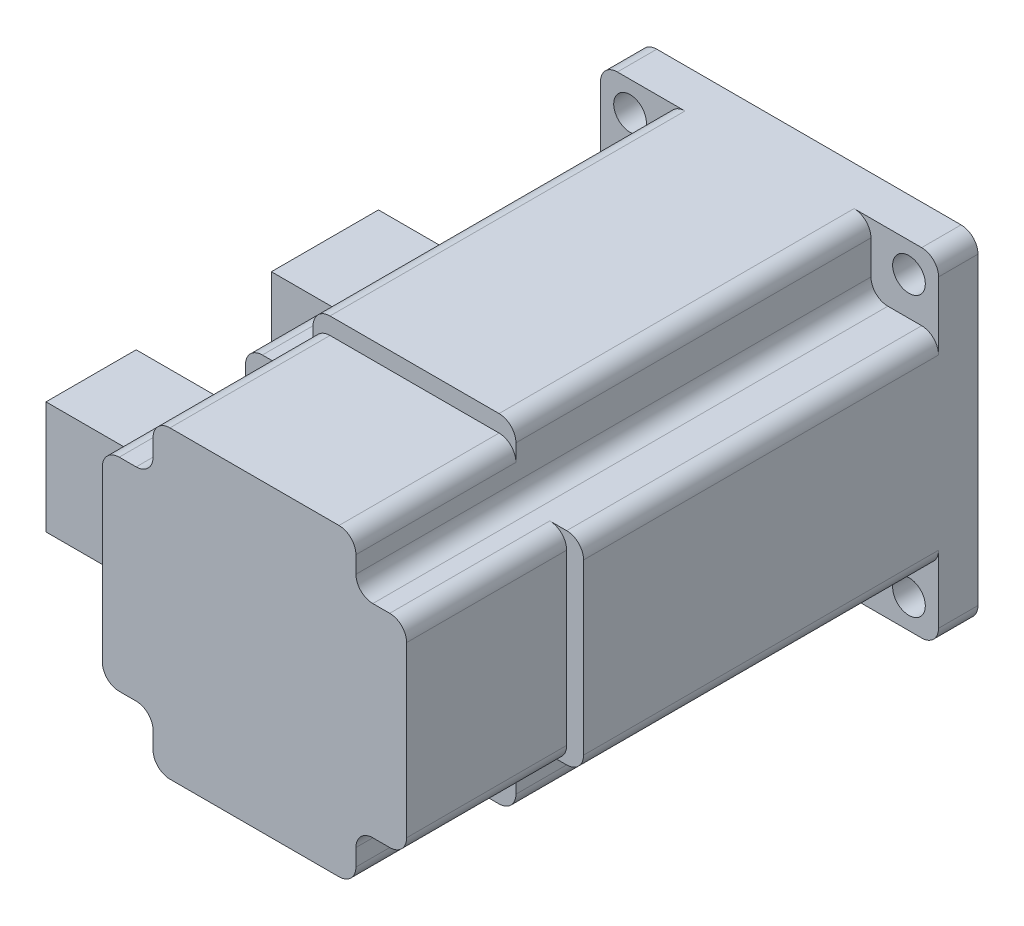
SolidWorks part; units mm, degrees
ref_plane "前视基准面" through (0, 0, 0) normal (0, 0, 1) x (1, 0, 0)
ref_plane "上视基准面" through (0, 0, 0) normal (0, 1, 0) x (1, 0, 0)
ref_plane "右视基准面" through (0, 0, 0) normal (1, 0, 0) x (0, 0, -1)
sketch "草图1" plane through (0, 0, 0) normal (0, 0, 1) x (1, 0, 0)
  line L0 (0, 27) -> (0, -27) construction
  line B0 (24, -18) -> (27, -18)
  line B1 (30, -15) -> (30, 15)
  line B2 (27, 18) -> (24, 18)
  line B3 (18, 24) -> (18, 27)
  line B4 (15, 30) -> (-15, 30)
  line B5 (-18, 27) -> (-18, 24)
  line B6 (-27, -18) -> (-24, -18)
  line B7 (-24, 18) -> (-27, 18)
  line B8 (-30, 15) -> (-30, -15)
  line B9 (-18, -24) -> (-18, -27)
  line B10 (-15, -30) -> (15, -30)
  line B11 (18, -27) -> (18, -24)
  line B12 (18, 21) -> (18, 24)
  line B13 (21, 18) -> (24, 18)
  line B14 (-18, 21) -> (-18, 24)
  line B15 (-24, 18) -> (-21, 18)
  line B16 (-24, -18) -> (-21, -18)
  line B17 (-18, -24) -> (-18, -21)
  line B18 (21, -18) -> (24, -18)
  line B19 (18, -24) -> (18, -21)
  arc B20 (27, -18) -> (30, -15) centre (27, -15) ccw
  arc B21 (30, 15) -> (27, 18) centre (27, 15) ccw
  arc B22 (18, 27) -> (15, 30) centre (15, 27) ccw
  arc B23 (-15, 30) -> (-18, 27) centre (-15, 27) ccw
  arc B24 (-27, 18) -> (-30, 15) centre (-27, 15) ccw
  arc B25 (-30, -15) -> (-27, -18) centre (-27, -15) ccw
  arc B26 (-18, -27) -> (-15, -30) centre (-15, -27) ccw
  arc B27 (15, -30) -> (18, -27) centre (15, -27) ccw
  arc B28 (18, 21) -> (21, 18) centre (21, 21) ccw
  arc B29 (-21, 18) -> (-18, 21) centre (-21, 21) ccw
  arc B30 (-18, -21) -> (-21, -18) centre (-21, -21) ccw
  arc B31 (21, -18) -> (18, -21) centre (21, -21) ccw
sketch_block_instance "块1-1"
sketch_block "块1"
extrude "凸台-拉伸1" add sketch "草图1" along normal blind 91.4
sketch "草图2" plane through (0, 0, 91.4) normal (0, 0, 1) x (1, 0, 0)
  line L0 (0, 27) -> (0, -27) construction
  line B0 (-15, -27) -> (15, -27)
  line B1 (18, -24) -> (18, -21)
  line B2 (21, -18) -> (24, -18)
  line B3 (27, -15) -> (27, 15)
  line B4 (24, 18) -> (21, 18)
  line B5 (18, 21) -> (18, 24)
  line B6 (15, 27) -> (-15, 27)
  line B7 (-18, 24) -> (-18, 21)
  line B8 (-21, 18) -> (-24, 18)
  line B9 (-27, 15) -> (-27, -15)
  line B10 (-24, -18) -> (-21, -18)
  line B11 (-18, -21) -> (-18, -24)
  arc B12 (15, -27) -> (18, -24) centre (15, -24) ccw
  arc B13 (21, -18) -> (18, -21) centre (21, -21) ccw
  arc B14 (24, -18) -> (27, -15) centre (24, -15) ccw
  arc B15 (27, 15) -> (24, 18) centre (24, 15) ccw
  arc B16 (18, 21) -> (21, 18) centre (21, 21) ccw
  arc B17 (18, 24) -> (15, 27) centre (15, 24) ccw
  arc B18 (-15, 27) -> (-18, 24) centre (-15, 24) ccw
  arc B19 (-21, 18) -> (-18, 21) centre (-21, 21) ccw
  arc B20 (-24, 18) -> (-27, 15) centre (-24, 15) ccw
  arc B21 (-27, -15) -> (-24, -18) centre (-24, -15) ccw
  arc B22 (-18, -21) -> (-21, -18) centre (-21, -21) ccw
  arc B23 (-18, -24) -> (-15, -27) centre (-15, -24) ccw
sketch_block_instance "块2-1"
sketch_block "块2"
extrude "切除-拉伸1" cut sketch "草图2" against normal blind 28.4 flip side to cut
sketch "草图3" plane through (0, 0, 0) normal (0, 0, -1) x (-1, 0, 0)
  line L0 (-15, 30) -> (15, 30) construction
  line L1 (-27, -30) -> (27, -30)
  line L2 (-30, -27) -> (-30, 27)
  line L3 (-27, 30) -> (27, 30)
  line L4 (30, -27) -> (30, 27)
  line L5 (-30, -30) -> (30, 30) construction
  line L6 (-30, 30) -> (30, -30) construction
  line L7 (30, 15) -> (30, -15) construction
  arc A0 (-27, -30) -> (-30, -27) centre (-27, -27) cw
  arc A1 (27, -30) -> (30, -27) centre (27, -27) ccw
  arc A2 (27, 30) -> (30, 27) centre (27, 27) cw
  arc A3 (-30, 27) -> (-27, 30) centre (-27, 27) cw
  point P0 (0, 0)
  dimension "D1" = 3
extrude "凸台-拉伸2" add sketch "草图3" along normal blind 7
sketch "草图4" plane through (0, 0, 0) normal (0, 0, 1) x (1, 0, 0)
  line L0 (0, 0) -> (0, 17.6698) construction
  line L1 (0, 0) -> (-15.3656, 0) construction
  circle A0 centre (-24.75, 24.75) radius 2.9
  circle A1 centre (24.75, 24.75) radius 2.9
  circle A2 centre (24.75, -24.75) radius 2.9
  circle A3 centre (-24.75, -24.75) radius 2.9
  dimension "D3" = 5.8
  dimension "D1" = 49.5
  dimension "D2" = 49.5
extrude "切除-拉伸2" cut sketch "草图4" against normal up to surface (7 mm away)
sketch "草图5" plane through (-30, 0, 0) normal (-1, 0, 0) x (0, 0, 1)
  line L0 (91.4, 15) -> (91.4, -15) construction
  line L1 (22.4, -10) -> (41.4, -10)
  line L2 (22.4, -10) -> (22.4, 10)
  line L3 (22.4, 10) -> (41.4, 10)
  line L4 (41.4, -10) -> (41.4, 10)
  line L5 (22.4, -10) -> (41.4, 10) construction
  line L6 (22.4, 10) -> (41.4, -10) construction
  line L7 (65.4, -10) -> (81.4, -10)
  line L8 (65.4, -10) -> (65.4, 10)
  line L9 (65.4, 10) -> (81.4, 10)
  line L10 (81.4, -10) -> (81.4, 10)
  line L11 (65.4, -10) -> (81.4, 10) construction
  line L12 (65.4, 10) -> (81.4, -10) construction
  point P0 (31.9, 0)
  point P5 (73.4, 0)
  point P10 (33.2758, 0)
  point P14 (0, 0)
  dimension "D1" = 40
  dimension "D2" = 10
  dimension "D3" = 20
  dimension "D4" = 16
  dimension "D5" = 19
extrude "凸台-拉伸3" add sketch "草图5" along normal blind 17
